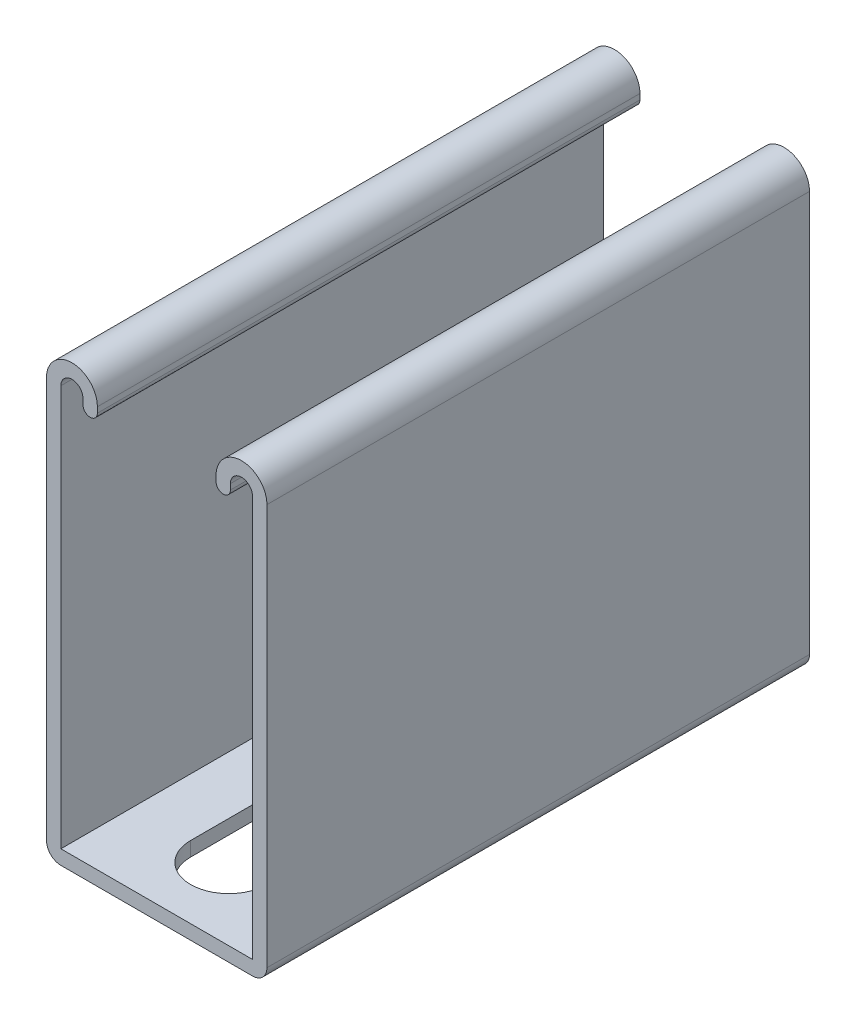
SolidWorks part; units mm, degrees
ref_plane "Plane1" through (0, 0, 0) normal (0, 0, 1) x (1, 0, 0)
ref_plane "Plane2" through (0, 0, 0) normal (0, 1, 0) x (1, 0, 0)
ref_plane "Plane3" through (0, 0, 0) normal (1, 0, 0) x (0, 0, -1)
sketch "Sketch1" plane through (0, 0, 0) normal (0, 0, 1) x (1, 0, 0)
  line L0 (-20.6375, 39.6875) -> (-20.6375, -35.4076)
  line L1 (-17.9451, -38.1) -> (17.9451, -38.1)
  line L2 (20.6375, -35.4076) -> (20.6375, 39.6875)
  line L3 (11.1125, 39.6875) -> (11.1125, 38.6524)
  line L4 (-11.1125, 39.6875) -> (-11.1125, 38.6524)
  line L5 (-13.8049, 39.6875) -> (-13.8049, 38.6524)
  line L6 (-17.9451, 39.6875) -> (-17.9451, -35.4076)
  line L7 (-17.9451, -35.4076) -> (17.9451, -35.4076)
  line L8 (17.9451, -35.4076) -> (17.9451, 39.6875)
  line L9 (13.8049, 39.6875) -> (13.8049, 38.6524)
  line L10 (-25.4, 44.45) -> (25.4, 44.45) construction
  line L11 (-12.8524, 37.3062) -> (12.8524, 37.3062) construction
  arc A0 (20.6375, 39.6875) -> (11.1125, 39.6875) centre (15.875, 39.6875) ccw
  arc A1 (-20.6375, 39.6875) -> (-11.1125, 39.6875) centre (-15.875, 39.6875) cw
  arc A2 (-17.9451, -38.1) -> (-20.6375, -35.4076) centre (-17.9451, -35.4076) cw
  arc A3 (17.9451, -38.1) -> (20.6375, -35.4076) centre (17.9451, -35.4076) ccw
  arc A4 (-17.9451, 39.6875) -> (-13.8049, 39.6875) centre (-15.875, 39.6875) cw
  arc A5 (17.9451, 39.6875) -> (13.8049, 39.6875) centre (15.875, 39.6875) ccw
  arc A6 (11.1125, 38.6524) -> (13.8049, 38.6524) centre (12.4587, 38.6524) ccw
  arc A7 (-11.1125, 38.6524) -> (-13.8049, 38.6524) centre (-12.4587, 38.6524) cw
  dimension "D1" = 2.6924
  dimension "D3" = 20.6375
  dimension "Width" = 41.275
  dimension "D5" = 38.1
  dimension "D6" = 9.525
  dimension "D7" = 22.225
  dimension "D8" = 44.45
  dimension "D9" = 7.1437
  dimension "gauge" = 2.6924
extrude "Base-Extrude" add sketch "Sketch1" along normal blind 101.6
extrude "Slot" cut sketch "Sketch2" against normal through all
sketch "Sketch2" plane through (-0.5607, -38.1, -14.6683) normal (0, -1, 0) x (1, 0, 0)
  line L0 (7.7045, 51.9746) -> (7.7045, 37.6871)
  line L1 (-6.583, 37.6871) -> (-6.583, 51.9746)
  arc A0 (-6.583, 37.6871) -> (7.7045, 37.6871) centre (0.5607, 37.6871) ccw
  arc A1 (7.7045, 51.9746) -> (-6.583, 51.9746) centre (0.5607, 51.9746) ccw
  dimension "D3" = 14.2875
  dimension "D1" = 23.0188
  dimension "D2" = 14.2875
pattern_linear "LPattern1" count 2 spacing 50.8 along (0, 0, 1) of "Slot"
equation "\"D3@Sketch1\" = \"Width@Sketch1\" / 2"
equation "\"D7@Sketch1\" = \"Width@Sketch1\" - 2 * \"D6@Sketch1\""
equation "\"D1@Sketch1\" = \"gauge@Sketch1\""
equation "\"D1@LPattern1\" = \"D1@Base-Extrude\" / \"D3@LPattern1\""
